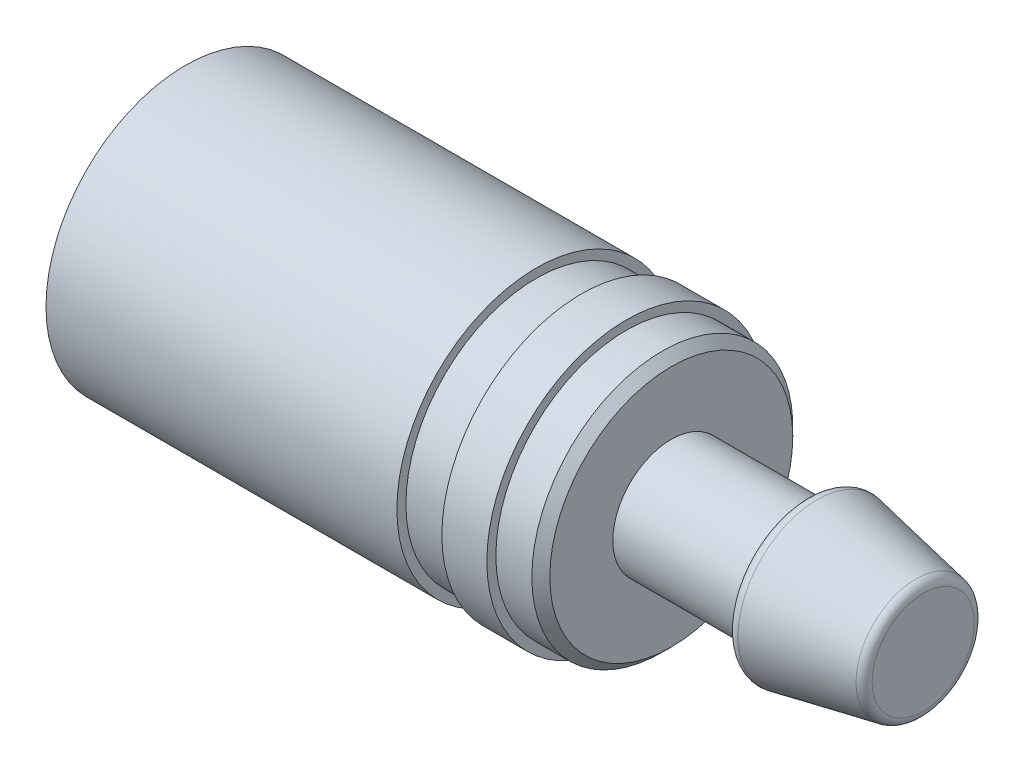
SolidWorks part; units mm, degrees
ref_plane "Alzado" through (0, 0, 0) normal (0, 0, 1) x (1, 0, 0)
ref_plane "Planta" through (0, 0, 0) normal (0, 1, 0) x (1, 0, 0)
ref_plane "Vista lateral" through (0, 0, 0) normal (1, 0, 0) x (0, 0, -1)
sketch "Croquis1" plane through (0, 0, 0) normal (0, 0, 1) x (1, 0, 0)
  line L0 (0, 0) -> (36.1529, 0) construction
  line L1 (0, 0) -> (0, 15.5)
  line L2 (0, 15.5) -> (39, 15.5)
  line L3 (39, 15.5) -> (39, 14.5)
  line L4 (39, 14.5) -> (44, 14.5)
  line L5 (44, 14.5) -> (44, 15.5)
  line L6 (44, 15.5) -> (49, 15.5)
  line L7 (49, 15.5) -> (49, 14.5)
  line L8 (49, 14.5) -> (54, 14.5)
  line L9 (54, 14.5) -> (54, 6.5)
  line L10 (54, 6.5) -> (69, 6.5)
  line L11 (69, 6.5) -> (69, 9)
  line L12 (69, 9) -> (82, 6.5)
  line L15 (0, 0) -> (82, 0)
  line L16 (82, 0) -> (82, 6.5)
  dimension "D1" = 31
  dimension "D2" = 39
  dimension "D3" = 1
  dimension "D4" = 5
  dimension "D5" = 5
  dimension "D6" = 5
  dimension "D7" = 13
  dimension "D8" = 15
  dimension "D9" = 13
  dimension "D10" = 28
  dimension "D11" = 18
revolve "Revolución1" add sketch "Croquis1" angle 360 about L0
fillet "Redondeo1" radius 1 2 edges at (82, 0, 6.5) (69, 0, 9)
chamfer "Chaflán1" distance 1 angle 45 1 edges at (54, 0, 14.5)
